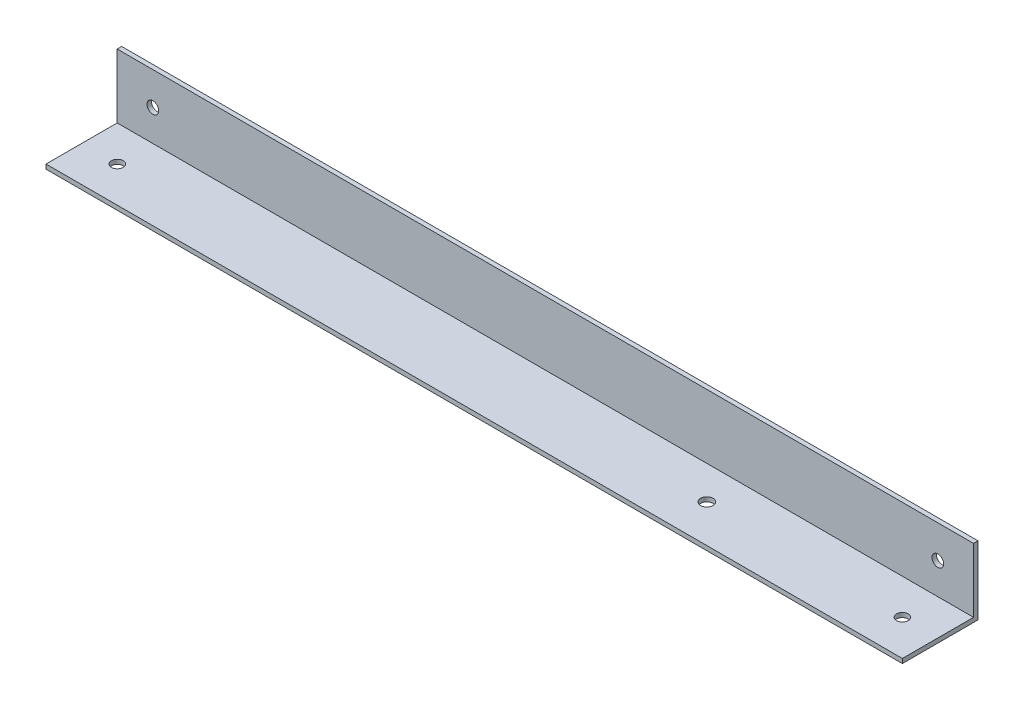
SolidWorks part; units mm, degrees
ref_plane "Front" through (0, 0, 0) normal (0, 0, 1) x (1, 0, 0)
ref_plane "Top" through (0, 0, 0) normal (0, 1, 0) x (1, 0, 0)
ref_plane "Right" through (0, 0, 0) normal (1, 0, 0) x (0, 0, -1)
sketch "Sketch1" plane through (0, 0, 0) normal (0, 0, 1) x (1, 0, 0)
  line L1 (-209.8261, 67.8385) -> (94.9739, 67.8385)
  line L2 (-209.8261, 67.8385) -> (-209.8261, 43.4545)
  line L3 (-209.8261, 43.4545) -> (94.9739, 43.4545)
  line L4 (94.9739, 67.8385) -> (94.9739, 43.4545)
  dimension "D1" = 304.8
  dimension "D2" = 24.384
extrude "Boss-Extrude1" add sketch "Sketch1" along normal blind 26.924
sketch "Sketch2" plane through (0, 67.8385, 0) normal (0, 1, 0) x (1, 0, 0)
  line L0 (-209.8261, -26.924) -> (-209.8261, 0) construction
  line L1 (-209.8261, -1.5875) -> (94.9739, -1.5875)
  line L2 (-209.8261, -1.5875) -> (-209.8261, -26.924)
  line L3 (-209.8261, -26.924) -> (94.9739, -26.924)
  line L4 (94.9739, -1.5875) -> (94.9739, -26.924)
  line L5 (94.9739, 0) -> (-209.8261, 0) construction
  dimension "D1" = 1.5875
extrude "Cut-Extrude1" cut sketch "Sketch2" against normal blind 12.7
sketch "Sketch3" plane through (0, 0, 26.924) normal (0, 0, 1) x (1, 0, 0)
  line L0 (94.9739, 43.4545) -> (94.9739, 55.1385) construction
  line L1 (-209.8261, 55.1385) -> (94.9739, 55.1385)
  line L2 (-209.8261, 55.1385) -> (-209.8261, 45.042)
  line L3 (-209.8261, 45.042) -> (94.9739, 45.042)
  line L4 (94.9739, 55.1385) -> (94.9739, 45.042)
  line L5 (-209.8261, 43.4545) -> (94.9739, 43.4545) construction
  dimension "D1" = 1.5875
extrude "Cut-Extrude3" cut sketch "Sketch3" against normal up to surface (25.3365 mm away)
sketch "Sketch4" plane through (0, 0, 0) normal (0, 0, -1) x (-1, 0, 0)
  line L0 (-94.9739, 43.4545) -> (-94.9739, 67.8385) construction
  line L1 (209.8261, 43.4545) -> (-94.9739, 43.4545) construction
  line L2 (57.4261, 28.0211) -> (57.4261, 119.205) construction
  circle A0 centre (-82.2739, 56.1545) radius 2.0828
  circle A1 centre (197.1261, 56.1545) radius 2.0828
  dimension "D3" = 4.1656
  dimension "D1" = 12.7
  dimension "D2" = 12.7
extrude "Cut-Extrude4" cut sketch "Sketch4" against normal blind 2.54
sketch "Sketch5" plane through (0, 43.4545, 0) normal (0, -1, 0) x (1, 0, 0)
  line L0 (-57.4261, 38.6497) -> (-57.4261, -24.6724) construction
  line L1 (-209.8261, 26.924) -> (-209.8261, 0) construction
  line L2 (-209.8261, 26.924) -> (94.9739, 26.924) construction
  circle A0 centre (-197.1261, 14.224) radius 2.0828
  circle A1 centre (82.2739, 14.224) radius 2.0828
  dimension "D1" = 4.1656
  dimension "D2" = 12.7
  dimension "D3" = 12.7
extrude "Cut-Extrude5" cut sketch "Sketch5" against normal blind 2.54
sketch "Sketch7" plane through (0, 43.4545, 0) normal (0, -1, 0) x (1, 0, 0)
  line L0 (-209.8261, 26.924) -> (-209.8261, 0) construction
  line L1 (94.9739, 26.924) -> (94.9739, 0) construction
  circle A0 centre (11.9159, 13.462) radius 2.235
  point P5 (-209.8261, 13.462)
  dimension "D2" = 4.47
  dimension "D1" = 83.058
extrude "Cut-Extrude6" cut sketch "Sketch7" against normal blind 2.54
equation "\".5n\"=1"
